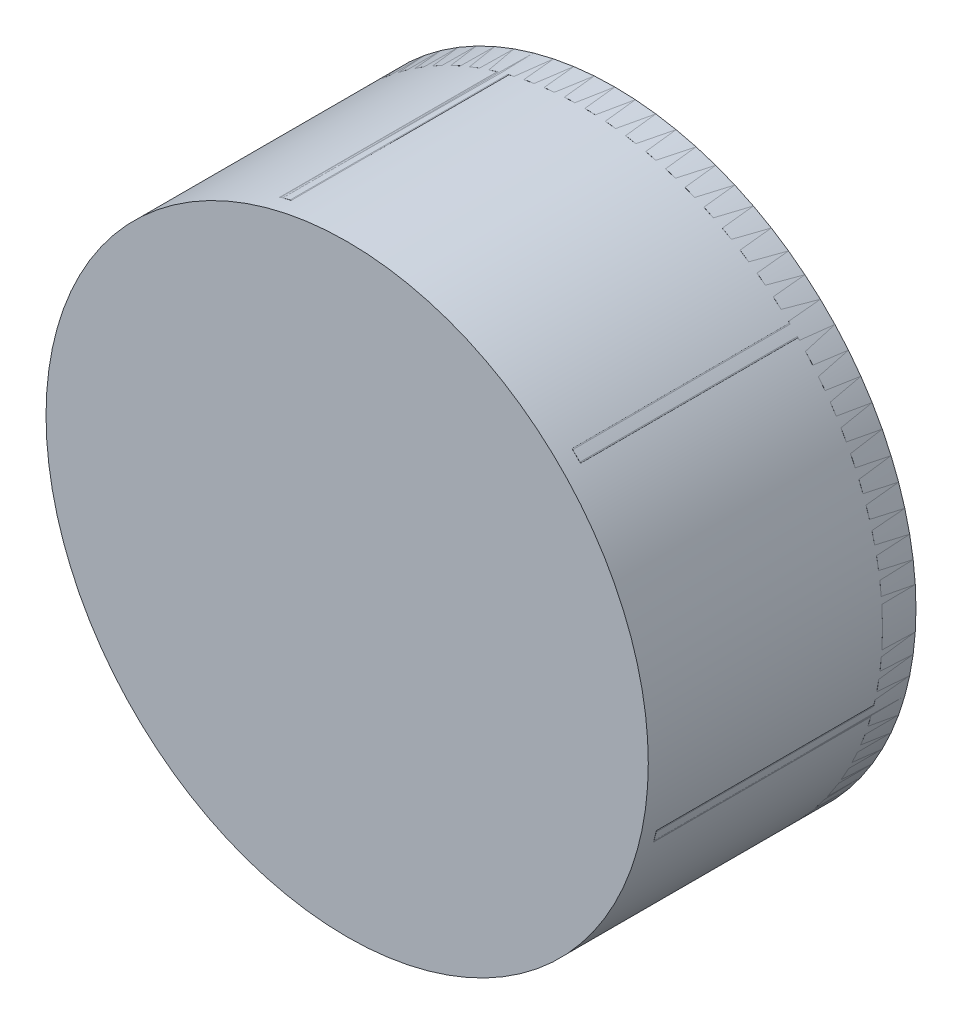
SolidWorks part; units mm, degrees
ref_plane "Front Plane" through (0, 0, 0) normal (0, 0, 1) x (1, 0, 0)
ref_plane "Top Plane" through (0, 0, 0) normal (0, 1, 0) x (1, 0, 0)
ref_plane "Right Plane" through (0, 0, 0) normal (1, 0, 0) x (0, 0, -1)
sketch "Sketch2" plane through (0, 0, 0) normal (0, 0, 1) x (1, 0, 0)
  circle A0 centre (0, 0) radius 18
  circle A1 centre (0, 0) radius 1
  dimension "D1" = 36
  dimension "D2" = 2
extrude "Boss-Extrude1" add sketch "Sketch2" against normal blind 2
sketch "Sketch5" plane through (0, 0, 0) normal (0, 0, 1) x (1, 0, 0)
  circle A0 centre (0, 0) radius 1
  circle A1 centre (0, 0) radius 2
  dimension "D1" = 4
  dimension "D2" = 2
extrude "Boss-Extrude3" add sketch "Sketch5" along normal blind 6
fillet "Fillet6" radius 1 2 edges at (2, 0, 6) (2, 0, 0)
sketch "Sketch6" plane through (0, 0, 0) normal (0, 0, 1) x (1, 0, 0)
  line L0 (0, 0) -> (11.6116, 11.6627) construction
  line L1 (6.0048, 5.3225) -> (13.0494, 12.3981)
  line L2 (5.2961, 6.0281) -> (12.3407, 13.1037)
  line L3 (5.2961, 6.0281) -> (6.0048, 5.3225)
  circle A0 centre (0, 0) radius 8.0241 construction
  circle A2 centre (0, 0) radius 18 construction
  arc A3 (13.0494, 12.3981) -> (12.3407, 13.1037) centre (0, 0) ccw
  dimension "D1" = 0.5
  dimension "D2" = 0.5
extrude "Boss-Extrude4" add sketch "Sketch6" along normal blind 13
fillet "Fillet7" radius 0.2 4 edges at (5.2961, 6.0281, 6.5) (6.0048, 5.3225, 6.5) (13.0494, 12.3981, 6.5) (12.3407, 13.1037, 6.5)
pattern_circular "CirPattern2" count 6 over 360 about axis through (0, 0, 0) along (0, 0, 1) of "Boss-Extrude4", "Fillet7"
sketch "Sketch7" plane through (0, 0, -2) normal (0, 0, -1) x (-1, 0, 0)
  circle A0 centre (0, 0) radius 18
  dimension "D1" = 36
extrude "Boss-Extrude5" add sketch "Sketch7" against normal blind 16 separate body
